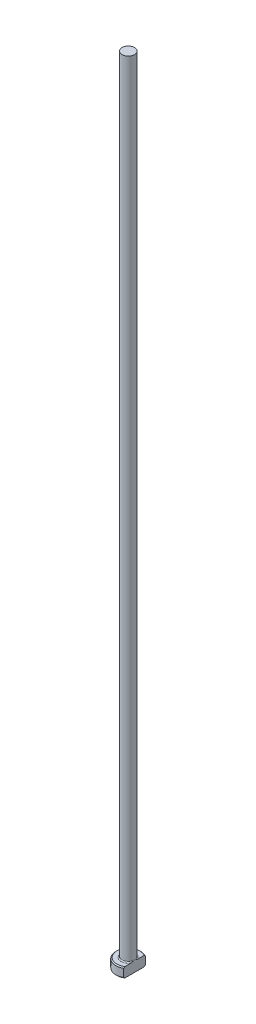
SolidWorks part; units mm, degrees
ref_plane "Front Plane" through (0, 0, 0) normal (0, 0, 1) x (1, 0, 0)
ref_plane "Top Plane" through (0, 0, 0) normal (0, 1, 0) x (1, 0, 0)
ref_plane "Right Plane" through (0, 0, 0) normal (1, 0, 0) x (0, 0, -1)
sketch "Sketch1" plane through (0, 0, 0) normal (0, 0, 1) x (1, 0, 0)
  line L0 (0, 259.9588) -> (0, -15.1925) construction
  line L1 (0, 0) -> (-2.5, 0)
  line L2 (-2.5, 0) -> (-2.5, 2)
  line L3 (-2.5, 2) -> (-1.25, 2)
  line L4 (-1.25, 2) -> (-1.25, 160)
  line L5 (-1.25, 160) -> (0, 160)
  line L6 (0, 160) -> (0, 0)
  dimension "L" = 160
  dimension "H" = 5
  dimension "T" = 2
  dimension "D" = 2.5
revolve "Revolve1" add sketch "Sketch1" angle 360 about L0
chamfer "Chamfer1" distance 0.2 angle 45 2 edges at (0, 2, 2.5) (0, 0, 2.5)
fillet "Fillet1" radius 0.2 1 edges at (0, 2, 1.25)
sketch "Sketch2" plane through (0, 0, 0) normal (0, 1, 0) x (1, 0, 0)
  line L0 (1.25, 2.1651) -> (1.25, -2.1651)
  circle A0 centre (0, 0) radius 2.5 construction
  arc A1 (1.25, -2.1651) -> (1.25, 2.1651) centre (0, 0) ccw
  circle A2 centre (0, 0) radius 1.25 construction
extrude "KEY" cut sketch "Sketch2" along normal through all
